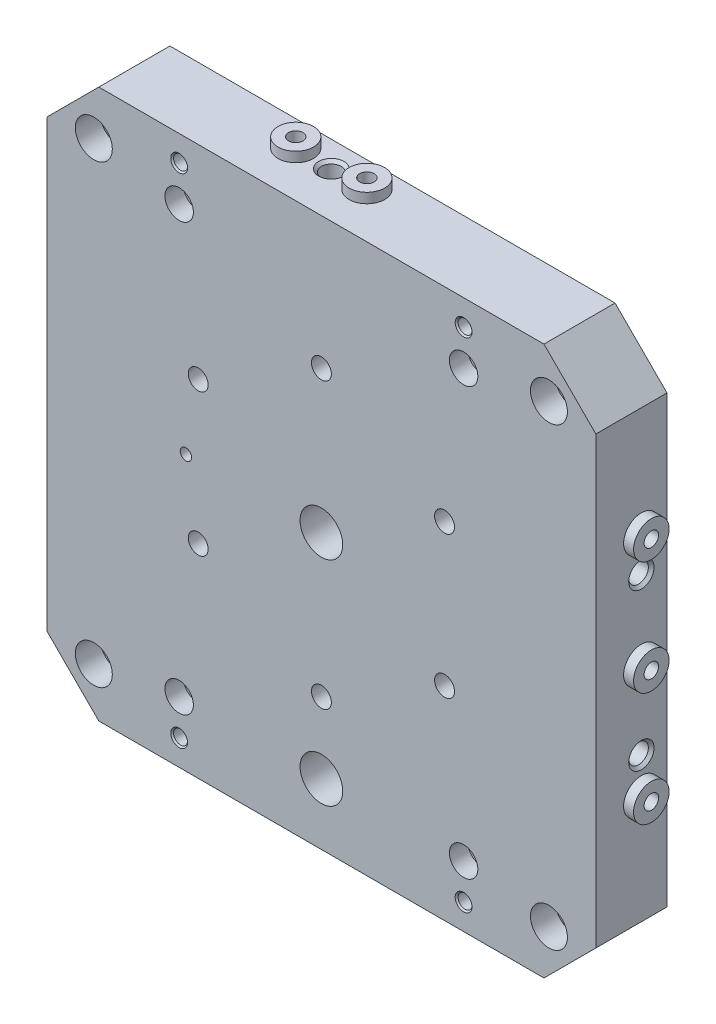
SolidWorks part; units mm, degrees
ref_plane "Plan de face" through (0, 0, 0) normal (0, 0, 1) x (1, 0, 0)
ref_plane "Plan de dessus" through (0, 0, 0) normal (0, 1, 0) x (1, 0, 0)
ref_plane "Plan de droite" through (0, 0, 0) normal (1, 0, 0) x (0, 0, -1)
sketch "Esquisse1" plane through (0, 0, 0) normal (0, 0, 1) x (1, 0, 0)
  line L0 (-193, -156.5) -> (-156.5, -193)
  line L1 (-156.5, -193) -> (156.5, -193)
  line L2 (156.5, -193) -> (193, -156.5)
  line L3 (193, -156.5) -> (193, 156.5)
  line L4 (193, 156.5) -> (156.5, 193)
  line L5 (156.5, 193) -> (-156.5, 193)
  line L6 (-156.5, 193) -> (-193, 156.5)
  line L7 (-193, 156.5) -> (-193, -156.5)
extrude "Boss.-Extru.1" add sketch "Esquisse1" along normal blind 50
ref_plane "Plan4" through (0, 193, 0) normal (0, 1, 0) x (-1, 0, 0)
sketch "Esquisse2" plane through (0, 193, 0) normal (0, 1, 0) x (-1, 0, 0)
  circle A0 centre (0, 18) radius 12.5
extrude "Boss.-Extru.2" add sketch "Esquisse2" along normal blind 7
sketch "Esquisse3" plane through (0, 193, 0) normal (0, 1, 0) x (-1, 0, 0)
  circle A0 centre (50, 18) radius 12.5
extrude "Boss.-Extru.3" add sketch "Esquisse3" along normal blind 7
ref_plane "Plan5" through (0, 160, 0) normal (0, 1, 0) x (-1, 0, 0)
sketch "Esquisse4" plane through (0, 160, 0) normal (0, 1, 0) x (-1, 0, 0)
  line L0 (160, -1) -> (151.25, -1)
  line L1 (151.25, -1) -> (151.25, 32.5)
  line L2 (151.25, 32.5) -> (147, 32.5)
  line L3 (147, 32.5) -> (147, 51)
  line L4 (147, 51) -> (160, 51)
  line L5 (160, 51) -> (160, -1)
  line L6 (160, 51) -> (160, -1) construction
revolve "Enlèvement de matière-Révolution1" cut sketch "Esquisse4" angle 360 about L6
sketch "Esquisse5" plane through (0, 160, 0) normal (0, 1, 0) x (-1, 0, 0)
  line L0 (-160, -1) -> (-168.75, -1)
  line L1 (-168.75, -1) -> (-168.75, 32.5)
  line L2 (-168.75, 32.5) -> (-173, 32.5)
  line L3 (-173, 32.5) -> (-173, 51)
  line L4 (-173, 51) -> (-160, 51)
  line L5 (-160, 51) -> (-160, -1)
  line L6 (-160, 51) -> (-160, -1) construction
revolve "Enlèvement de matière-Révolution2" cut sketch "Esquisse5" angle 360 about L6
ref_plane "Plan6" through (0, -160, 0) normal (0, 1, 0) x (-1, 0, 0)
sketch "Esquisse6" plane through (0, -160, 0) normal (0, 1, 0) x (-1, 0, 0)
  line L0 (-160, -1) -> (-168.75, -1)
  line L1 (-168.75, -1) -> (-168.75, 32.5)
  line L2 (-168.75, 32.5) -> (-173, 32.5)
  line L3 (-173, 32.5) -> (-173, 51)
  line L4 (-173, 51) -> (-160, 51)
  line L5 (-160, 51) -> (-160, -1)
  line L6 (-160, 51) -> (-160, -1) construction
revolve "Enlèvement de matière-Révolution3" cut sketch "Esquisse6" angle 360 about L6
sketch "Esquisse7" plane through (0, -160, 0) normal (0, 1, 0) x (-1, 0, 0)
  line L0 (160, -1) -> (151.25, -1)
  line L1 (151.25, -1) -> (151.25, 32.5)
  line L2 (151.25, 32.5) -> (147, 32.5)
  line L3 (147, 32.5) -> (147, 51)
  line L4 (147, 51) -> (160, 51)
  line L5 (160, 51) -> (160, -1)
  line L6 (160, 51) -> (160, -1) construction
revolve "Enlèvement de matière-Révolution4" cut sketch "Esquisse7" angle 360 about L6
sketch "Esquisse8" plane through (0, 0, 0) normal (0, 1, 0) x (1, 0, 0)
  line L0 (0, 1) -> (15, 1)
  line L1 (15, 1) -> (15, -51)
  line L2 (15, -51) -> (0, -51)
  line L3 (0, -51) -> (0, 1)
  line L4 (0, -51) -> (0, 1) construction
revolve "Enlèvement de matière-Révolution5" cut sketch "Esquisse8" angle 360 about L4
ref_plane "Plan7" through (0, -150, 0) normal (0, 1, 0) x (-1, 0, 0)
sketch "Esquisse9" plane through (0, -150, 0) normal (0, 1, 0) x (-1, 0, 0)
  line L0 (0, -1) -> (-15, -1)
  line L1 (-15, -1) -> (-15, 51)
  line L2 (-15, 51) -> (0, 51)
  line L3 (0, 51) -> (0, -1)
  line L4 (0, 51) -> (0, -1) construction
revolve "Enlèvement de matière-Révolution6" cut sketch "Esquisse9" angle 360 about L4
ref_plane "Plan8" through (0, 150, 0) normal (0, 1, 0) x (-1, 0, 0)
sketch "Esquisse10" plane through (0, 150, 0) normal (0, 1, 0) x (-1, 0, 0)
  line L0 (-100, 51) -> (-90, 51)
  line L1 (-90, 51) -> (-90, 37)
  line L2 (-90, 37) -> (-93.25, 37)
  line L3 (-93.25, 37) -> (-93.25, -1)
  line L4 (-93.25, -1) -> (-100, -1)
  line L5 (-100, -1) -> (-100, 51)
  line L6 (-100, -1) -> (-100, 51) construction
revolve "Enlèvement de matière-Révolution7" cut sketch "Esquisse10" angle 360 about L6
sketch "Esquisse11" plane through (0, 150, 0) normal (0, 1, 0) x (-1, 0, 0)
  line L0 (100, 51) -> (110, 51)
  line L1 (110, 51) -> (110, 37)
  line L2 (110, 37) -> (106.75, 37)
  line L3 (106.75, 37) -> (106.75, -1)
  line L4 (106.75, -1) -> (100, -1)
  line L5 (100, -1) -> (100, 51)
  line L6 (100, -1) -> (100, 51) construction
revolve "Enlèvement de matière-Révolution8" cut sketch "Esquisse11" angle 360 about L6
ref_plane "Plan9" through (0, -150, 0) normal (0, 1, 0) x (-1, 0, 0)
sketch "Esquisse12" plane through (0, -150, 0) normal (0, 1, 0) x (-1, 0, 0)
  line L0 (-100, 51) -> (-90, 51)
  line L1 (-90, 51) -> (-90, 37)
  line L2 (-90, 37) -> (-93.25, 37)
  line L3 (-93.25, 37) -> (-93.25, -1)
  line L4 (-93.25, -1) -> (-100, -1)
  line L5 (-100, -1) -> (-100, 51)
  line L6 (-100, -1) -> (-100, 51) construction
revolve "Enlèvement de matière-Révolution9" cut sketch "Esquisse12" angle 360 about L6
sketch "Esquisse13" plane through (0, -150, 0) normal (0, 1, 0) x (-1, 0, 0)
  line L0 (100, 51) -> (110, 51)
  line L1 (110, 51) -> (110, 37)
  line L2 (110, 37) -> (106.75, 37)
  line L3 (106.75, 37) -> (106.75, -1)
  line L4 (106.75, -1) -> (100, -1)
  line L5 (100, -1) -> (100, 51)
  line L6 (100, -1) -> (100, 51) construction
revolve "Enlèvement de matière-Révolution10" cut sketch "Esquisse13" angle 360 about L6
ref_plane "Plan10" through (0, 175, 0) normal (0, 1, 0) x (-1, 0, 0)
sketch "Esquisse14" plane through (0, 175, 0) normal (0, 1, 0) x (-1, 0, 0)
  line L0 (100, -2) -> (92.083, -2)
  line L1 (92.083, -2) -> (95.083, 1)
  line L2 (95.083, 1) -> (95.083, 49)
  line L3 (95.083, 49) -> (92.083, 52)
  line L4 (92.083, 52) -> (100, 52)
  line L5 (100, 52) -> (100, -2)
  line L6 (100, 52) -> (100, -2) construction
revolve "Enlèvement de matière-Révolution11" cut sketch "Esquisse14" angle 360 about L6
sketch "Esquisse15" plane through (0, 175, 0) normal (0, 1, 0) x (-1, 0, 0)
  line L0 (-100, -2) -> (-107.917, -2)
  line L1 (-107.917, -2) -> (-104.917, 1)
  line L2 (-104.917, 1) -> (-104.917, 49)
  line L3 (-104.917, 49) -> (-107.917, 52)
  line L4 (-107.917, 52) -> (-100, 52)
  line L5 (-100, 52) -> (-100, -2)
  line L6 (-100, 52) -> (-100, -2) construction
revolve "Enlèvement de matière-Révolution12" cut sketch "Esquisse15" angle 360 about L6
ref_plane "Plan11" through (0, -175, 0) normal (0, 1, 0) x (-1, 0, 0)
sketch "Esquisse16" plane through (0, -175, 0) normal (0, 1, 0) x (-1, 0, 0)
  line L0 (100, -2) -> (92.083, -2)
  line L1 (92.083, -2) -> (95.083, 1)
  line L2 (95.083, 1) -> (95.083, 49)
  line L3 (95.083, 49) -> (92.083, 52)
  line L4 (92.083, 52) -> (100, 52)
  line L5 (100, 52) -> (100, -2)
  line L6 (100, 52) -> (100, -2) construction
revolve "Enlèvement de matière-Révolution13" cut sketch "Esquisse16" angle 360 about L6
sketch "Esquisse17" plane through (0, -175, 0) normal (0, 1, 0) x (-1, 0, 0)
  line L0 (-100, -2) -> (-107.917, -2)
  line L1 (-107.917, -2) -> (-104.917, 1)
  line L2 (-104.917, 1) -> (-104.917, 49)
  line L3 (-104.917, 49) -> (-107.917, 52)
  line L4 (-107.917, 52) -> (-100, 52)
  line L5 (-100, 52) -> (-100, -2)
  line L6 (-100, 52) -> (-100, -2) construction
revolve "Enlèvement de matière-Révolution14" cut sketch "Esquisse17" angle 360 about L6
sketch "Esquisse18" plane through (0, 0, 0) normal (0, 1, 0) x (1, 0, 0)
  line L0 (150, -51) -> (140, -51)
  line L1 (140, -51) -> (140, -37)
  line L2 (140, -37) -> (143.25, -37)
  line L3 (143.25, -37) -> (143.25, 1)
  line L4 (143.25, 1) -> (150, 1)
  line L5 (150, 1) -> (150, -51)
  line L6 (150, 1) -> (150, -51) construction
revolve "Enlèvement de matière-Révolution15" [suppressed] cut sketch "Esquisse18" angle 360 about L6
sketch "Esquisse19" plane through (0, 0, 0) normal (0, 1, 0) x (1, 0, 0)
  line L0 (-150, -51) -> (-160, -51)
  line L1 (-160, -51) -> (-160, -37)
  line L2 (-160, -37) -> (-156.75, -37)
  line L3 (-156.75, -37) -> (-156.75, 1)
  line L4 (-156.75, 1) -> (-150, 1)
  line L5 (-150, 1) -> (-150, -51)
  line L6 (-150, 1) -> (-150, -51) construction
revolve "Enlèvement de matière-Révolution16" [suppressed] cut sketch "Esquisse19" angle 360 about L6
ref_plane "Plan12" through (-25, 0, 0) normal (1, 0, 0) x (0, 0, -1)
sketch "Esquisse20" plane through (-25, 0, 0) normal (1, 0, 0) x (0, 0, -1)
  line L0 (-18, 194) -> (-8.0825, 194)
  line L1 (-8.0825, 194) -> (-11.0825, 191)
  line L2 (-11.0825, 191) -> (-11.0825, 127.9938)
  line L3 (-11.0825, 127.9938) -> (-18, 124)
  line L4 (-18, 124) -> (-18, 194)
  line L5 (-18, 124) -> (-18, 194) construction
revolve "Enlèvement de matière-Révolution17" cut sketch "Esquisse20" angle 360 about L5
ref_plane "Plan13" through (193, 0, 0) normal (1, 0, 0) x (0, 0, -1)
sketch "Esquisse21" plane through (193, 0, 0) normal (1, 0, 0) x (0, 0, -1)
  circle A0 centre (-18, 0) radius 12.5
extrude "Boss.-Extru.4" add sketch "Esquisse21" along normal blind 7
sketch "Esquisse22" plane through (193, 0, 0) normal (1, 0, 0) x (0, 0, -1)
  circle A0 centre (-18, 80) radius 12.5
extrude "Boss.-Extru.5" add sketch "Esquisse22" along normal blind 7
sketch "Esquisse23" plane through (193, 0, 0) normal (1, 0, 0) x (0, 0, -1)
  circle A0 centre (-18, -80) radius 12.5
extrude "Boss.-Extru.6" add sketch "Esquisse23" along normal blind 7
ref_plane "Plan14" through (0, 55, 0) normal (0, 1, 0) x (-1, 0, 0)
sketch "Esquisse24" plane through (0, 55, 0) normal (0, 1, 0) x (-1, 0, 0)
  line L0 (-194, 18) -> (-194, 27.9175)
  line L1 (-194, 27.9175) -> (-191, 24.9175)
  line L2 (-191, 24.9175) -> (-127.9938, 24.9175)
  line L3 (-127.9938, 24.9175) -> (-124, 18)
  line L4 (-124, 18) -> (-194, 18)
  line L5 (-124, 18) -> (-194, 18) construction
revolve "Enlèvement de matière-Révolution18" cut sketch "Esquisse24" angle 360 about L5
ref_plane "Plan15" through (0, -55, 0) normal (0, 1, 0) x (-1, 0, 0)
sketch "Esquisse25" plane through (0, -55, 0) normal (0, 1, 0) x (-1, 0, 0)
  line L0 (-194, 18) -> (-194, 27.9175)
  line L1 (-194, 27.9175) -> (-191, 24.9175)
  line L2 (-191, 24.9175) -> (-127.9938, 24.9175)
  line L3 (-127.9938, 24.9175) -> (-124, 18)
  line L4 (-124, 18) -> (-194, 18)
  line L5 (-124, 18) -> (-194, 18) construction
revolve "Enlèvement de matière-Révolution19" cut sketch "Esquisse25" angle 360 about L5
ref_plane "Plan16" through (0, 200, 0) normal (0, 1, 0) x (-1, 0, 0)
sketch "Esquisse26" plane through (0, 200, 0) normal (0, 1, 0) x (-1, 0, 0)
  circle A0 centre (0, 18) radius 5
extrude "Enlèv. mat.-Extru.1" cut sketch "Esquisse26" along normal blind 25 and the other way blind 25
ref_plane "Plan17" through (0, 200, 0) normal (0, 1, 0) x (-1, 0, 0)
sketch "Esquisse27" plane through (0, 200, 0) normal (0, 1, 0) x (-1, 0, 0)
  circle A0 centre (50, 18) radius 5
extrude "Enlèv. mat.-Extru.2" cut sketch "Esquisse27" along normal blind 25 and the other way blind 25
ref_plane "Plan18" through (200, 0, 0) normal (1, 0, 0) x (0, 0, -1)
sketch "Esquisse28" plane through (200, 0, 0) normal (1, 0, 0) x (0, 0, -1)
  circle A0 centre (-18, 80) radius 5
extrude "Enlèv. mat.-Extru.3" cut sketch "Esquisse28" along normal blind 25 and the other way blind 25
ref_plane "Plan19" through (200, 0, 0) normal (1, 0, 0) x (0, 0, -1)
sketch "Esquisse29" plane through (200, 0, 0) normal (1, 0, 0) x (0, 0, -1)
  circle A0 centre (-18, 0) radius 5
extrude "Enlèv. mat.-Extru.4" cut sketch "Esquisse29" along normal blind 25 and the other way blind 25
ref_plane "Plan20" through (200, 0, 0) normal (1, 0, 0) x (0, 0, -1)
sketch "Esquisse30" plane through (200, 0, 0) normal (1, 0, 0) x (0, 0, -1)
  circle A0 centre (-18, -80) radius 5
extrude "Enlèv. mat.-Extru.5" cut sketch "Esquisse30" along normal blind 25 and the other way blind 25
hole_wizard "Trou taraudé M121" positions "Esquisse32" profile "Esquisse31" tap size "M12" standard "ISO"
sketch "Esquisse32" plane through (200, 0, 0) normal (1, 0, 0) x (0, 0, -1)
  point P0 (-18, 80)
  point P1 (-18, 0)
  point P4 (-18, -80)
sketch "Esquisse31" plane through (200, 80, 18) normal (0, 1, 0) x (0, 0, -1)
  line L0 (0, 0) -> (0, 35.8144)
  line L1 (0, 35.8144) -> (5.1, 32.75)
  line L2 (5.1, 32.75) -> (5.1, 0)
  line L5 (5.1, 0) -> (0, 0)
  line L10 (0, 35.8144) -> (-5.1, 32.75) construction
  line L11 (0, -6.35) -> (0, 107.95) construction
  dimension "Diamètre du trou pour taraudage" = 10.2
  dimension "Profondeur du trou pour taraudage" = 32.75
  dimension "Angle de pointe" = 118
hole_wizard "Trou taraudé M122" positions "Esquisse34" profile "Esquisse33" tap size "M12" standard "ISO"
sketch "Esquisse34" plane through (0, 200, 0) normal (0, 1, 0) x (-1, 0, 0)
  point P0 (0, 18)
  point P1 (50, 18)
sketch "Esquisse33" plane through (0, 200, 18) normal (1, 0, 0) x (0, 0, 1)
  line L0 (0, 0) -> (0, 35.8144)
  line L1 (0, 35.8144) -> (5.1, 32.75)
  line L2 (5.1, 32.75) -> (5.1, 0)
  line L5 (5.1, 0) -> (0, 0)
  line L10 (0, 35.8144) -> (-5.1, 32.75) construction
  line L11 (0, -6.35) -> (0, 107.95) construction
  dimension "Diamètre du trou pour taraudage" = 10.2
  dimension "Profondeur du trou pour taraudage" = 32.75
  dimension "Angle de pointe" = 118
hole_wizard "Trou taraudé M161" positions "Esquisse35" profile "Esquisse36" tap size "M16" standard "ISO"
sketch "Esquisse35" plane through (0, 0, 50) normal (0, 0, 1) x (0, -1, 0)
  line L0 (0, 0) -> (-50, 86.6025) construction
  line L1 (0, 0) -> (0, -100) construction
  circle A0 centre (0, 0) radius 100 construction
  point P0 (-50, -86.6025)
  point P1 (-50, 86.6025)
  point P19 (50, 86.6025)
  point P21 (50, -86.6025)
  point P23 (100, 0)
  point P25 (-100, 0)
sketch "Esquisse36" plane through (-86.6025, 50, 50) normal (1, 0, 0) x (0, -1, 0)
  line L0 (0, 0) -> (0, 50)
  line L1 (0, 50) -> (7, 50)
  line L2 (7, 50) -> (7, 0)
  line L5 (7, 0) -> (0, 0)
  line L11 (0, -6.35) -> (0, 107.95) construction
  dimension "Diamètre du trou pour taraudage jusqu'au prochain" = 14
  dimension "Profondeur du trou pour taraudage jusqu'au prochain" = 50
hole_wizard "Diamètre du perçage Ø8.0 (8)1" positions "Esquisse38" profile "Esquisse39" hole size "Ø8.0" standard "ISO"
sketch "Esquisse38" plane through (0, 0, 50) normal (0, 0, 1) x (1, 0, 0)
  point P0 (-95.25, 0)
sketch "Esquisse39" plane through (-95.25, 0, 50) normal (1, 0, 0) x (0, -1, 0)
  line L0 (0, 0) -> (0, 50)
  line L1 (0, 50) -> (4, 50)
  line L2 (4, 50) -> (4, 0)
  line L5 (4, 0) -> (0, 0)
  line L11 (0, -6.35) -> (0, 107.95) construction
  dimension "Diamètre du perçage jusqu'au prochain" = 8
  dimension "Profondeur du perçage jusqu'au prochain" = 50
